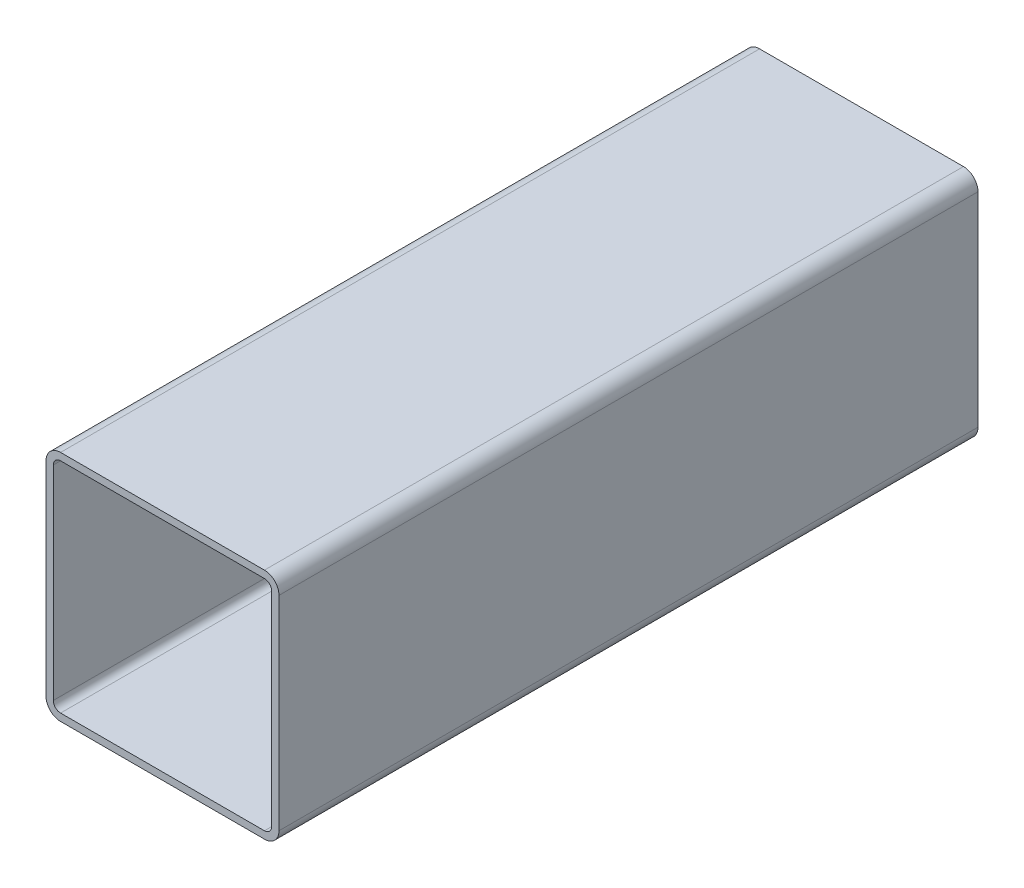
SolidWorks part; units mm, degrees
ref_plane "Front Plane" through (0, 0, 0) normal (0, 0, 1) x (1, 0, 0)
ref_plane "Top Plane" through (0, 0, 0) normal (0, 1, 0) x (1, 0, 0)
ref_plane "Right Plane" through (0, 0, 0) normal (1, 0, 0) x (0, 0, -1)
sketch "Sketch1" plane through (0, 0, 0) normal (0, 0, 1) x (1, 0, 0)
sketch_block_instance "HSS4x4x0.125-1"
sketch_block "HSS4x4x0.125"
extrude "Boss-Extrude1" add sketch "Sketch1" along normal blind 304.8
